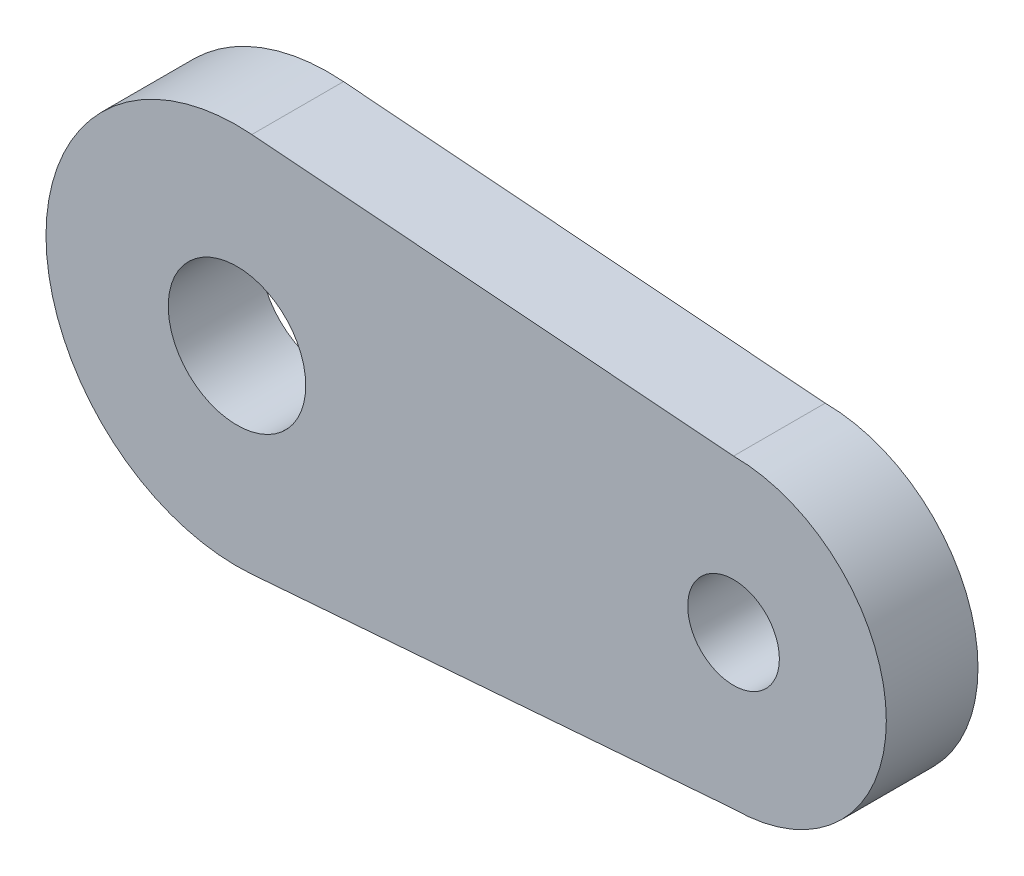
SolidWorks part; units mm, degrees
ref_plane "前视基准面" through (0, 0, 0) normal (0, 0, 1) x (1, 0, 0)
ref_plane "上视基准面" through (0, 0, 0) normal (0, 1, 0) x (1, 0, 0)
ref_plane "右视基准面" through (0, 0, 0) normal (1, 0, 0) x (0, 0, -1)
sketch "草图1" plane through (0, 0, 0) normal (0, 0, 1) x (1, 0, 0)
  line L0 (0, 0) -> (65, 0) construction
  line L1 (1.9464, -24.9241) -> (65, -20)
  line L2 (1.9464, 24.9241) -> (65, 20)
  circle A0 centre (0, 0) radius 9
  arc A1 (1.9464, 24.9241) -> (1.9464, -24.9241) centre (0, 0) ccw
  circle A2 centre (65, 0) radius 6
  arc A3 (65, -20) -> (65, 20) centre (65, 0) ccw
extrude "凸台-拉伸1" add sketch "草图1" along normal blind 12
